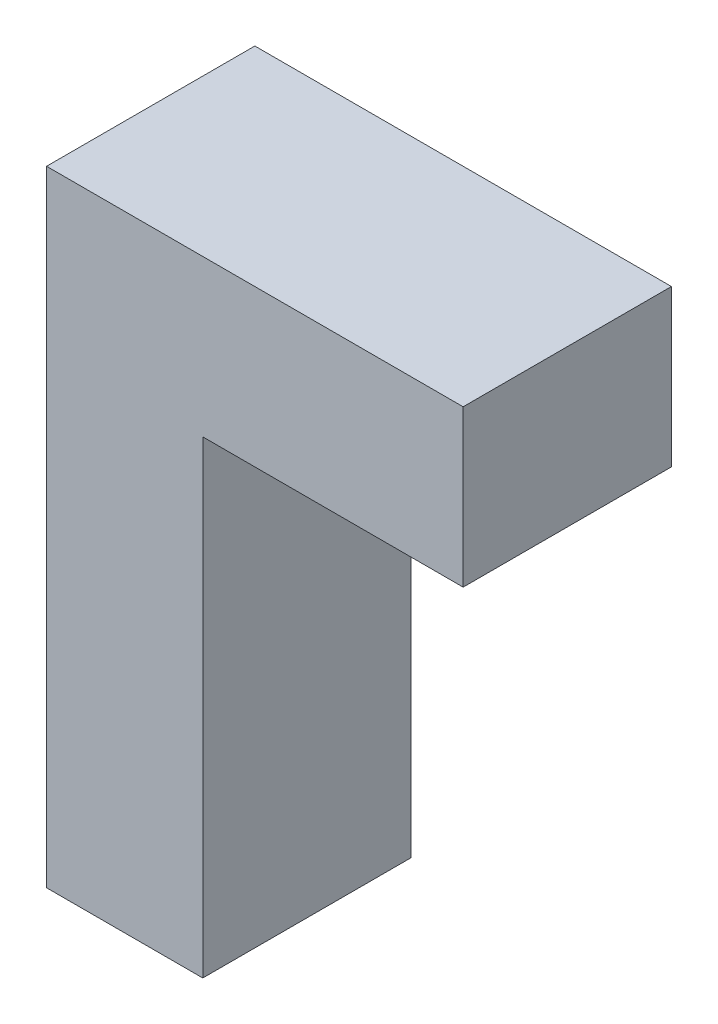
SolidWorks part; units mm, degrees
ref_plane "Front Plane" through (0, 0, 0) normal (0, 0, 1) x (1, 0, 0)
ref_plane "Top Plane" through (0, 0, 0) normal (0, 1, 0) x (1, 0, 0)
ref_plane "Right Plane" through (0, 0, 0) normal (1, 0, 0) x (0, 0, -1)
sketch "Sketch1" plane through (0, 0, 0) normal (0, 0, 1) x (1, 0, 0)
  line L0 (0, 0) -> (19.05, 0)
  line L1 (19.05, 0) -> (19.05, 57.15)
  line L2 (19.05, 57.15) -> (50.8, 57.15)
  line L3 (50.8, 57.15) -> (50.8, 76.2)
  line L4 (50.8, 76.2) -> (0, 76.2)
  line L5 (0, 76.2) -> (0, 0)
  dimension "D1" = 19.05
  dimension "D2" = 76.2
  dimension "D3" = 50.8
  dimension "D4" = 19.05
extrude "Extrude1" add sketch "Sketch1" along normal blind 25.4
